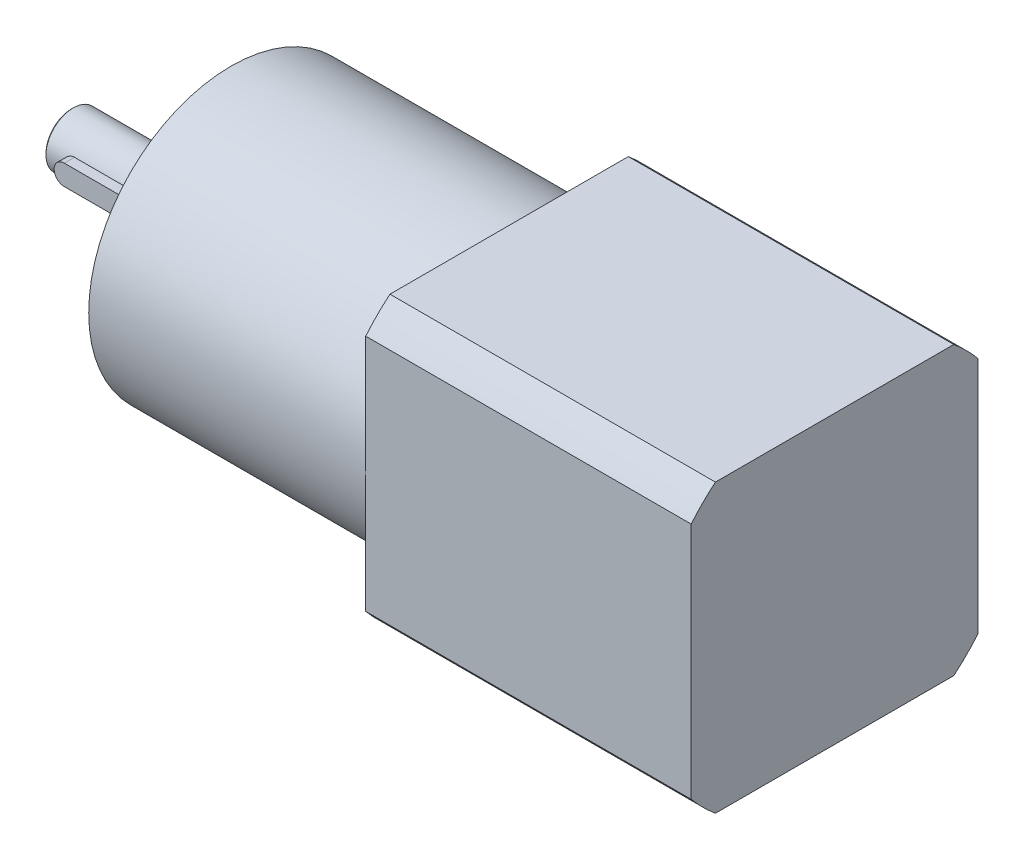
SolidWorks part; units mm, degrees
ref_plane "Plan1" through (0, 0, 0) normal (0, 0, 1) x (1, 0, 0)
ref_plane "Plan2" through (0, 0, 0) normal (0, 1, 0) x (1, 0, 0)
ref_plane "Plan3" through (0, 0, 0) normal (1, 0, 0) x (0, 0, -1)
sketch "Esquisse1" plane through (0, 0, 0) normal (0, 0, 1) x (1, 0, 0)
  line L0 (-41.0735, 0) -> (113.6856, 0) construction
  line L1 (50, 0) -> (-50, 0) construction
  line L2 (-2, 0) -> (-2, 12.5)
  line L3 (-2, 12.5) -> (0, 12.5)
  line L4 (0, 12.5) -> (0, 21)
  line L5 (0, 21) -> (41, 21)
  line L6 (41, 21) -> (41, 27.5)
  line L7 (41, 27.5) -> (89, 27.5)
  line L8 (89, 27.5) -> (89, 0)
  line L9 (89, 0) -> (-2, 0)
  line L10 (0, -50) -> (0, 50) construction
  dimension "D1" = 25
  dimension "D2" = 2
  dimension "D3" = 42
  dimension "D4" = 41
  dimension "D5" = 48
  dimension "D6" = 55
revolve "Révolution1" add sketch "Esquisse1" angle 360 about L0
sketch "Esquisse2" plane through (0, 0, 0) normal (0, 0, 1) x (1, 0, 0)
  line L0 (-41.2245, 0) -> (7.59, 0) construction
  line L1 (50, 0) -> (-50, 0) construction
  line L2 (-2, 12.5) -> (-2, -12.5) construction
  line L3 (-23.5, 4) -> (-2, 4)
  line L4 (-23.5, 4) -> (-23.5, 0)
  line L5 (-23.5, 0) -> (-2, 0)
  line L6 (-2, 4) -> (-2, 0)
  line L7 (0, 21) -> (0, -21) construction
  dimension "D1" = 8
  dimension "D2" = 23.5
revolve "Révolution2" add sketch "Esquisse2" angle 360 about L0
sketch "Esquisse3" plane through (0, 0, 0) normal (0, 0, 1) x (1, 0, 0)
  line L0 (-19.4, 0) -> (-8.4, 0) construction
  line L1 (-19.4, 1.5) -> (-8.4, 1.5)
  line L2 (-19.4, -1.5) -> (-8.4, -1.5)
  line L3 (-23.5, 4) -> (-23.5, -4) construction
  arc A0 (-19.4, 1.5) -> (-19.4, -1.5) centre (-19.4, 0) ccw
  arc A1 (-8.4, -1.5) -> (-8.4, 1.5) centre (-8.4, 0) ccw
  point P2 (-13.9, 0)
  dimension "D1" = 2.6
  dimension "D2" = 14
  dimension "D3" = 3
extrude "Boss.-Extru.1" add sketch "Esquisse3" along normal blind 5.2 separate body
chamfer "Chanfrein1" distance 0.2 angle 45 1 edges at (-23.5, -4, 0)
hole_wizard "Trou taraudé M41" positions "Esquisse4" profile "Esquisse5" tap size "M4" standard "ISO"
sketch "Esquisse4" plane through (0, 0, 0) normal (-1, 0, 0) x (0, 0, 1)
  circle A0 centre (0, 0) radius 17.5
  point P5 (0, 17.5)
  point P7 (17.5, 0)
  point P9 (0, -17.5)
  point P11 (-17.5, 0)
  dimension "D1" = 35
sketch "Esquisse5" plane through (0, 0, -17.5) normal (0, 1, 0) x (0, 0, 1)
  line L0 (0, 0) -> (0, 11.0914)
  line L1 (0, 11.0914) -> (1.65, 10.1)
  line L2 (1.65, 10.1) -> (1.65, 0)
  line L5 (1.65, 0) -> (0, 0)
  line L10 (0, 11.0914) -> (-1.65, 10.1) construction
  line L11 (0, -6.35) -> (0, 107.95) construction
  dimension "Diamètre du trou pour taraudage" = 3.3
  dimension "Profondeur du trou pour taraudage" = 10.1
  dimension "Angle de pointe" = 118
sketch "Esquisse6" plane through (41, 0, 0) normal (-1, 0, 0) x (0, 0, 1)
  line L1 (21.15, -21.15) -> (21.15, 21.15)
  line L2 (21.15, 21.15) -> (-21.15, 21.15)
  line L3 (-21.15, 21.15) -> (-21.15, -21.15)
  line L4 (-21.15, -21.15) -> (21.15, -21.15)
  circle A0 centre (0, 0) radius 21.15 construction
  dimension "D1" = 42.3
extrude "Enlèv. mat.-Extru.1" cut sketch "Esquisse6" against normal through all flip side to cut
